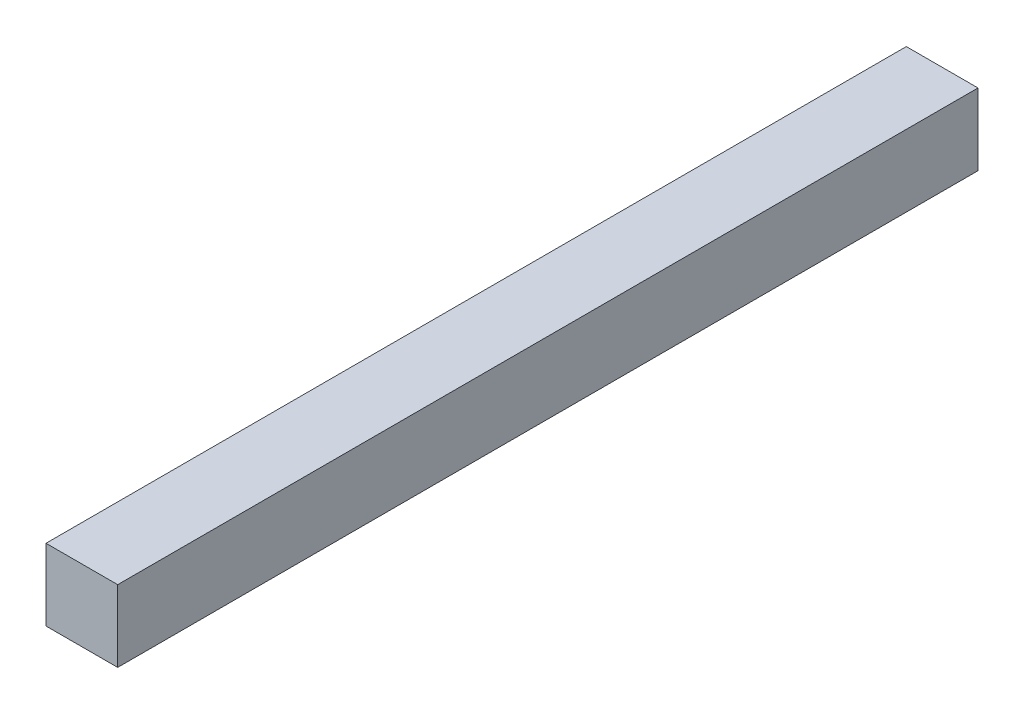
SolidWorks part; units mm, degrees
ref_plane "Face" through (0, 0, 0) normal (0, 0, 1) x (1, 0, 0)
ref_plane "Dessus" through (0, 0, 0) normal (0, 1, 0) x (1, 0, 0)
ref_plane "Droite" through (0, 0, 0) normal (1, 0, 0) x (0, 0, -1)
sketch "Esquisse1" plane through (0, 0, 0) normal (0, 0, 1) x (1, 0, 0)
  line L1 (0, 0) -> (25, 0)
  line L2 (0, 0) -> (0, 25)
  line L3 (0, 25) -> (25, 25)
  line L4 (25, 0) -> (25, 25)
  dimension "D1" = 25
  dimension "D2" = 25
extrude "Extrusion1" add sketch "Esquisse1" along normal blind 300
